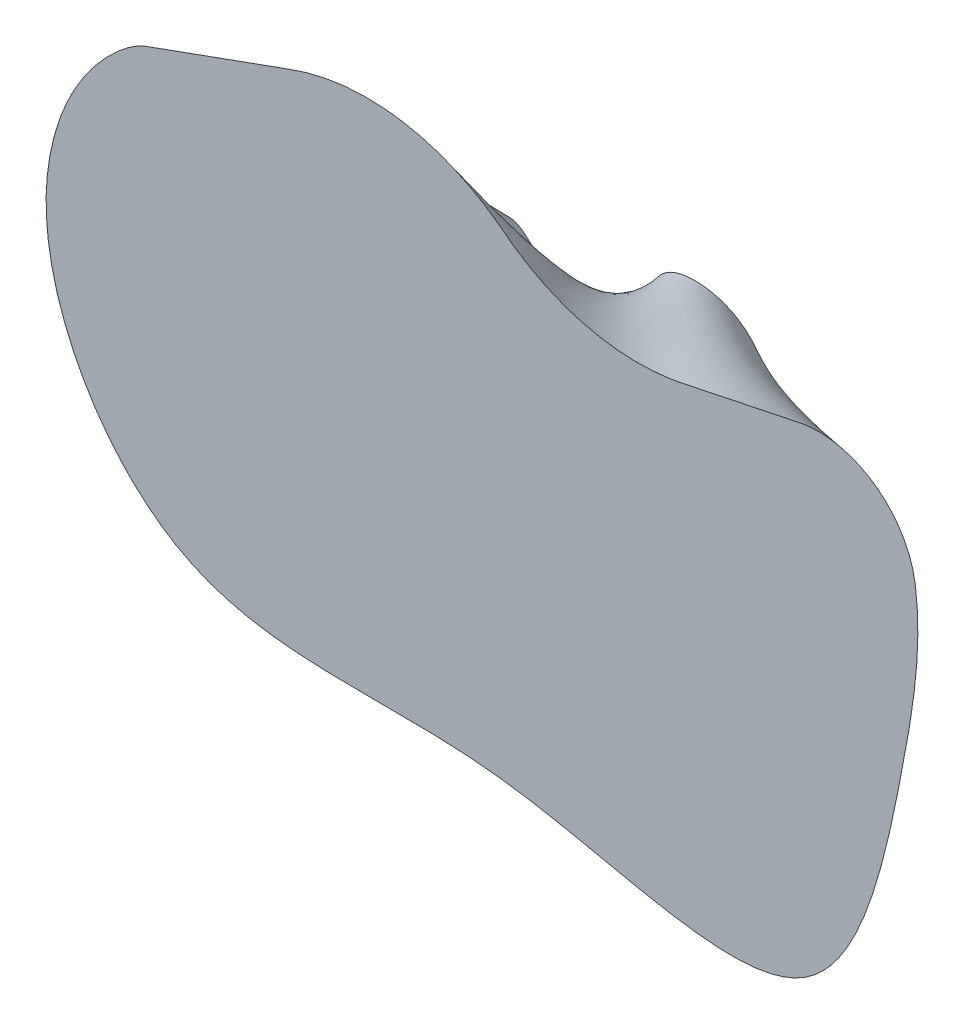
SolidWorks part; units mm, degrees
ref_plane "Ebene vorne" through (0, 0, 0) normal (0, 0, 1) x (1, 0, 0)
ref_plane "Ebene oben" through (0, 0, 0) normal (0, 1, 0) x (1, 0, 0)
ref_plane "Ebene rechts" through (0, 0, 0) normal (1, 0, 0) x (0, 0, -1)
sketch "Skizze1" plane through (0, 0, 0) normal (0, 0, 1) x (1, 0, 0)
  spline S0 degree 3 poles (6.3007, -18.5536) (0.0131, 1.8169) (-9, 14.847) (13.298, 37.2161) (23.6453, 11.1724) (45.5589, 20.5152) (48.2546, 39.7282) (76.1283, 38.209) (83.5112, 5.3964) (60.6305, -28.9684) (17.4986, -16.6241) (-20.6116, -40.2818) (-45.5005, 3.9614) (-16.989, -4.3623) (6.3007, -18.5536) (0.0131, 1.8169) (-9, 14.847) knots -0.159989 -0.097185 -0.036393 0 0.042239 0.110098 0.16153 0.220249 0.261919 0.316362 0.404424 0.509992 0.627515 0.767585 0.840011 0.902815 0.963607 1 1.042239 1.110098 1.16153 only from (0, 0) to (0, 0)
ref_plane "Ebene1" through (0, 0, 35) normal (0, 0, 1) x (1, 0, 0)
sketch "Skizze2" plane through (0, 0, 35) normal (0, 0, 1) x (1, 0, 0)
  line L0 (-45.609, 55.2566) -> (-8.8225, 68.548) construction
  line L1 (90.3694, 49.0817) -> (119.9273, 55.2566) construction
  arc A0 (-8.8225, 68.548) -> (44.9391, 59.7999) centre (10.2021, 15.8935) cw construction
  arc A1 (44.9391, 59.7999) -> (90.3694, 49.0817) centre (79.1078, 102.988) ccw construction
  arc A2 (119.9273, 55.2566) -> (149.7431, 34.048) centre (125.0241, 30.8596) cw construction
  spline S0 degree 3 poles (149.7431, 34.048) (151.4795, 20.5856) (145.849, -13.139) (129.3771, -88.171) (40.2785, -50.6991) (-38.789, -70.1177) (-81.0168, 0.3533) (-63.9606, 42.8861) (-48.5237, 54.2035) (-45.609, 55.2566) knots 0 0 0 0 0.108945 0.269677 0.468387 0.685175 0.855391 0.976238 1 1 1 1 construction
  spline S1 degree 3 number of poles 82 (121.0008, 55.4565) -> (121.0008, 55.4565)
loft "Ausformung1" add profiles "Skizze2", "Skizze1"
equation "\"LÄNGE\"=0"
equation "\"BREITE\"=0"
equation "\"HÖHE\"=0"
equation "\"DURCHMESSER\"=0"
equation "\"Stückzahl\"= 1"
